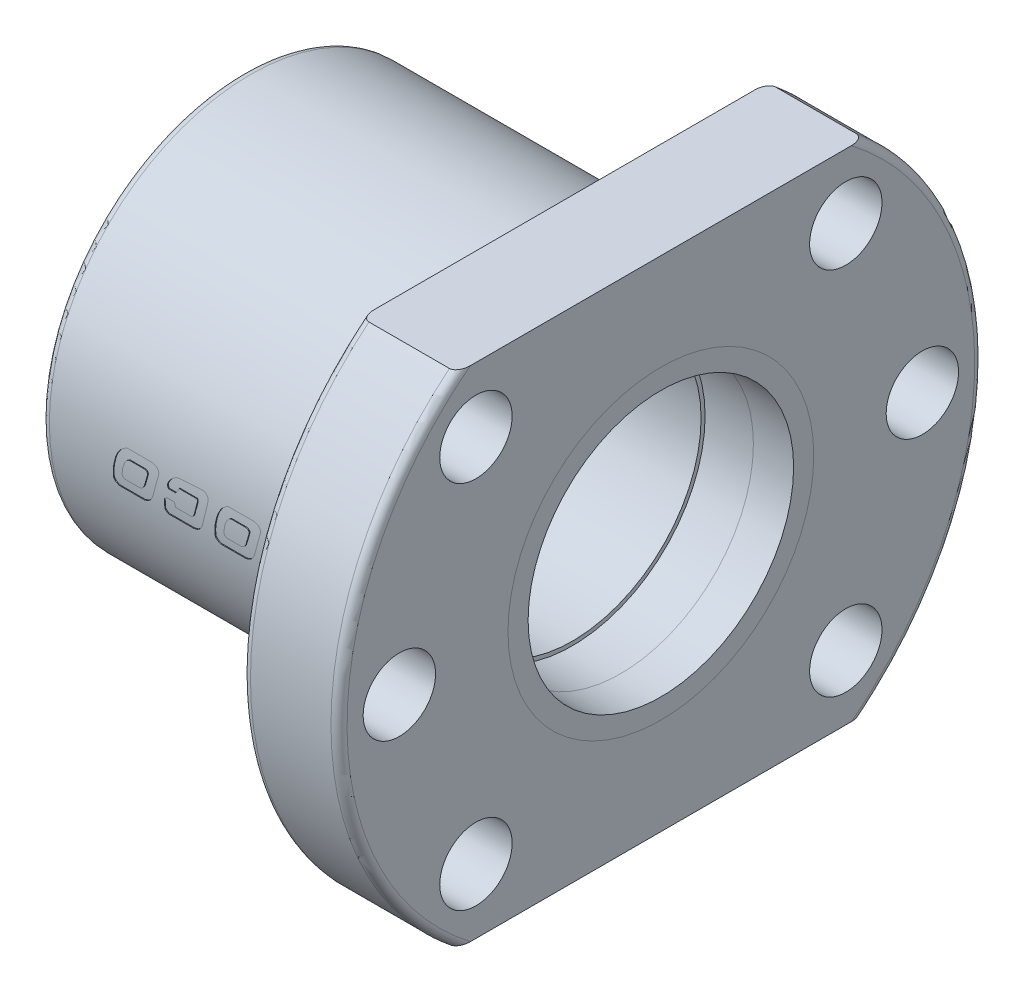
SolidWorks part; units mm, degrees
other "____1[2]"
other "____1[1]"
ref_plane "Front Plane" through (0, 0, 0) normal (0, 0, 1) x (1, 0, 0)
ref_plane "Top Plane" through (0, 0, 0) normal (0, 1, 0) x (1, 0, 0)
ref_plane "Right Plane" through (0, 0, 0) normal (1, 0, 0) x (0, 0, -1)
imported_body "Imported1"
imported_body "Imported2"
sketch "Sketch1" plane through (0, 0, 0) normal (1, 0, 0) x (0, 0, -1)
  circle A0 centre (0, 0) radius 16
extrude "Cut-Extrude1" cut sketch "Sketch1" against normal up to surface (94 mm away)
